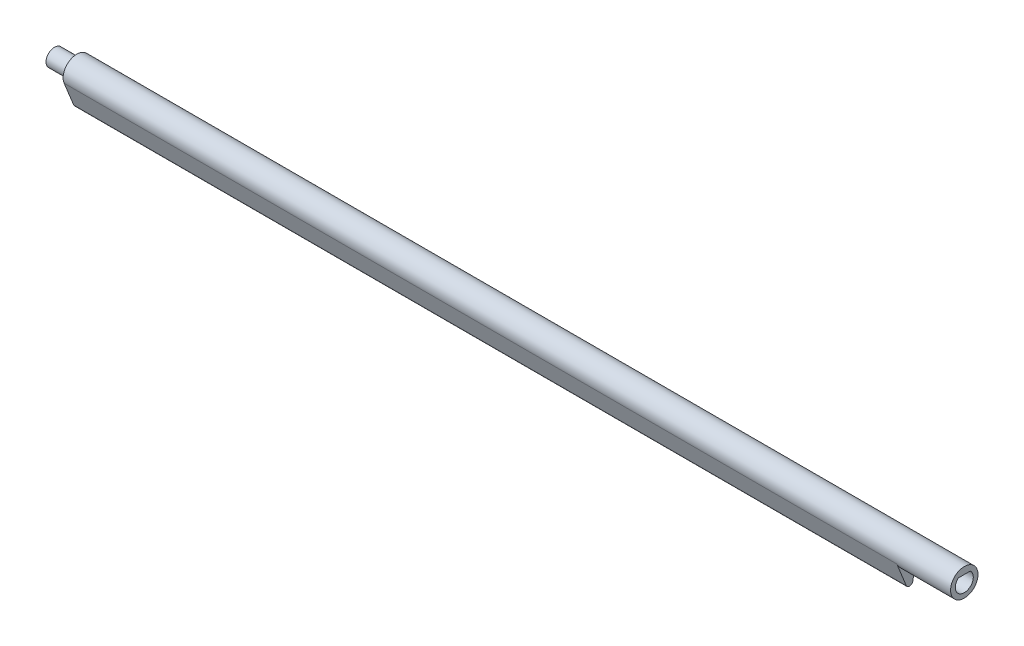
SolidWorks part; units mm, degrees
ref_plane "Front Plane" through (0, 0, 0) normal (0, 0, 1) x (1, 0, 0)
ref_plane "Top Plane" through (0, 0, 0) normal (0, 1, 0) x (1, 0, 0)
ref_plane "Right Plane" through (0, 0, 0) normal (1, 0, 0) x (0, 0, -1)
sketch "Sketch1" plane through (0, 0, 0) normal (1, 0, 0) x (0, 0, -1)
  line L1 (0, 0) -> (0, 42.2576) construction
  line L4 (-3.7081, 6.5) -> (-0.927, -0.375)
  line L5 (4, 8) -> (2, 6.2594)
  line L6 (2, 6.2594) -> (0.9878, -0.1559)
  arc A0 (-3.7081, 6.5) -> (0, 12) centre (0, 8) cw
  arc A1 (4, 8) -> (0, 12) centre (0, 8) ccw
  arc A2 (0.9878, -0.1559) -> (-0.927, -0.375) centre (0, 0) cw
  dimension "D2" = 4
  dimension "D3" = 1
  dimension "D1" = 8
  dimension "D4" = 2
  dimension "D5" = 140
extrude "Boss-Extrude1" add sketch "Sketch1" along normal mid plane 243
sketch "Sketch2" plane through (-121.5, 0, 0) normal (-1, 0, 0) x (0, 0, 1)
  circle A0 centre (0, 8) radius 2.5
  dimension "D1" = 5
extrude "Boss-Extrude2" add sketch "Sketch2" along normal blind 6.5
sketch "Sketch3" plane through (121.5, 0, 0) normal (1, 0, 0) x (0, 0, -1)
  circle A0 centre (0, 8) radius 2.625
  circle A1 centre (0, 8) radius 4
  dimension "D1" = 5.25
  dimension "D2" = 8
extrude "Boss-Extrude3" add sketch "Sketch3" along normal blind 16
sketch "Sketch4" plane through (137.5, 0, 0) normal (1, 0, 0) x (0, 0, -1)
  line L0 (-1.7292, 9.975) -> (1.7292, 9.975)
  circle A0 centre (0, 8) radius 2.625 construction
  circle A1 centre (0, 8) radius 2.625
  dimension "D1" = 4.6
extrude "Boss-Extrude4" add sketch "Sketch4" against normal up to surface (16 mm away) contours L0 M4
fillet "Fillet1" radius 2 2 edges at (121.5, 7.1297, -3) (121.5, 5.3201, -1.8518)
